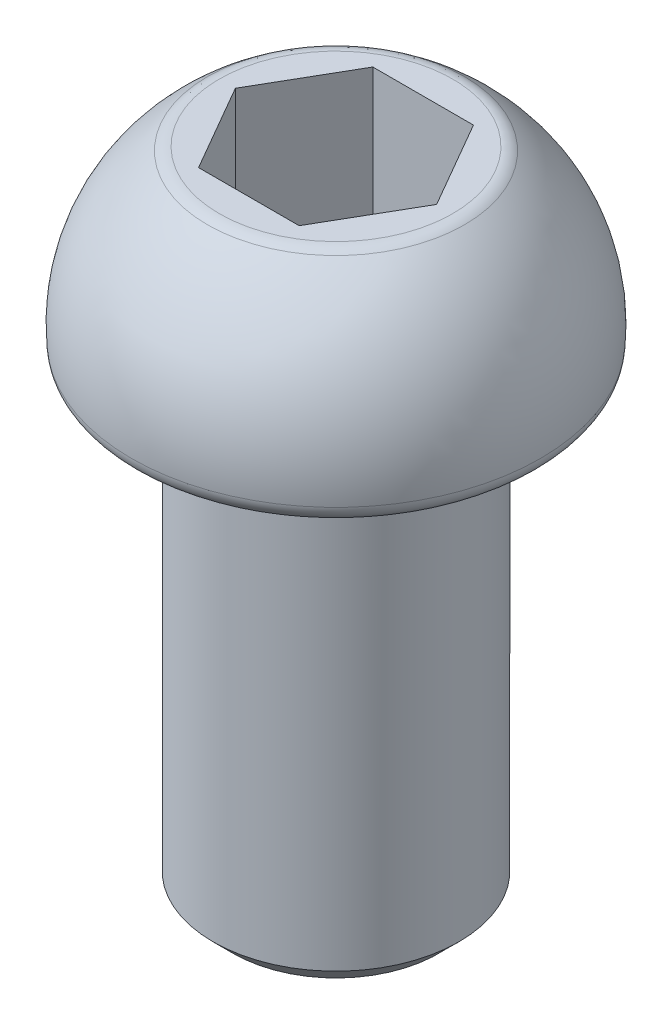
SolidWorks part; units mm, degrees
ref_plane "Plan1" through (0, 0, 0) normal (0, 0, 1) x (1, 0, 0)
ref_plane "Plan2" through (0, 0, 0) normal (0, 1, 0) x (1, 0, 0)
ref_plane "Plan3" through (0, 0, 0) normal (1, 0, 0) x (0, 0, -1)
sketch "Esquisse1" plane through (0, 0, 0) normal (0, 0, 1) x (1, 0, 0)
  line L0 (342.9972, 500.275) -> (342.9972, 468.0959) construction
  line L1 (342.9972, 500.275) -> (342.9972, 468.0959)
  line L170 (336.8868, 468.0959) -> (342.9972, 468.0959)
  line L171 (336.8868, 468.0959) -> (336.8868, 491.002)
  line L174 (336.8868, 491.002) -> (332.9565, 491.002)
  line L176 (336.8868, 500.275) -> (342.9972, 500.275)
  arc A48 (332.9565, 491.002) -> (336.8868, 500.275) centre (341.9618, 492.6546) cw
  point P399 (342.9972, 500.275)
revolve "Base-Révolution" add sketch "Esquisse1" angle 360 about L0
chamfer "Chanfrein1" distance 1 angle 45
sketch "Esquisse2" plane through (0, 500.275, 0) normal (0, 1, 0) x (-1, 0, 0)
  line L0 (-345.4972, 4.3301) -> (-340.4972, 4.3301)
  line L1 (-340.4972, 4.3301) -> (-337.9972, 0)
  line L2 (-337.9972, 0) -> (-340.4972, -4.3301)
  line L3 (-340.4972, -4.3301) -> (-345.4972, -4.3301)
  line L5 (-345.4972, 4.3301) -> (-347.9972, 0)
  line L6 (-347.9972, 0) -> (-345.4972, -4.3301)
  point P3 (-347.9972, 0)
  point P4 (-345.4972, 4.3301)
  point P7 (-340.4972, 4.3301)
  point P8 (-337.9972, 0)
  point P9 (-340.4972, -4.3301)
  point P10 (-345.4972, -4.3301)
extrude "Enlèv. mat.-Extru.1" cut sketch "Esquisse2" against normal blind 7
fillet "Congé1" radius 1
fillet "Congé2" radius 1
